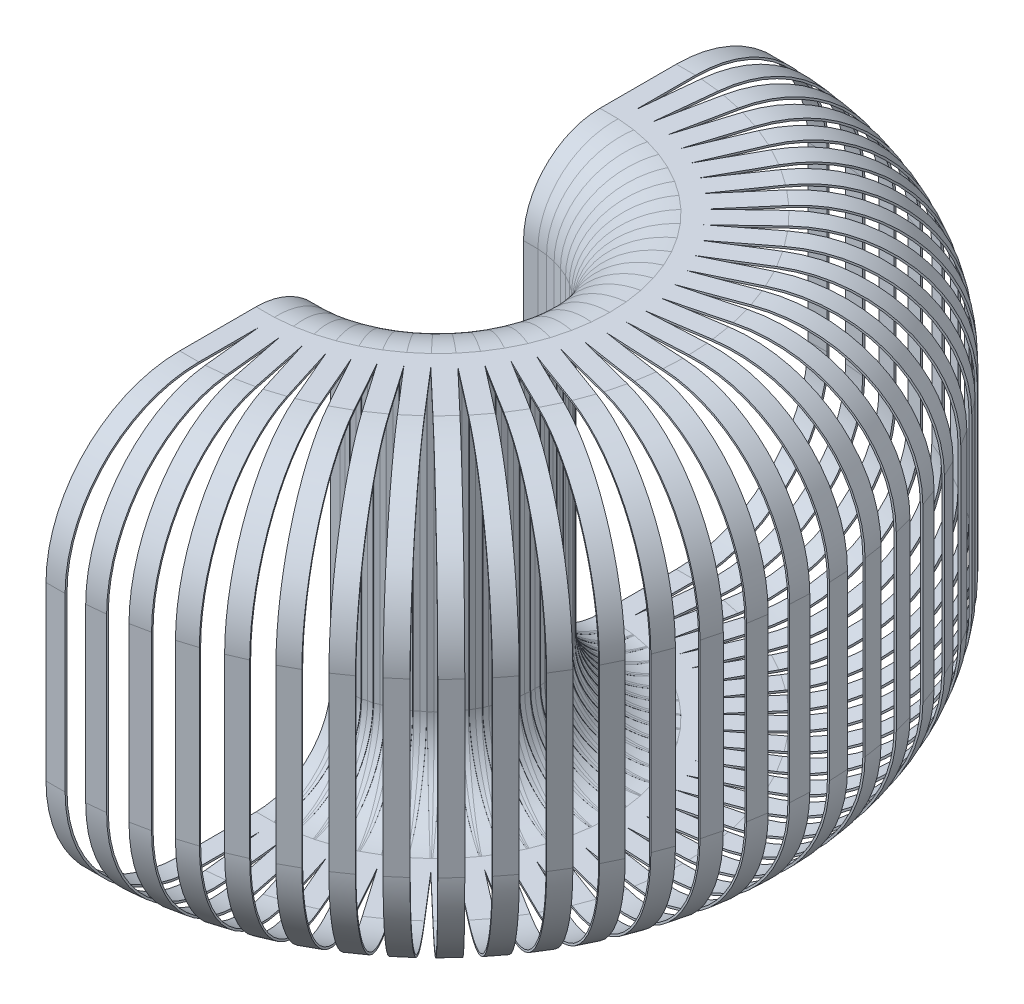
SolidWorks part; units mm, degrees
ref_plane "Alzado" through (0, 0, 0) normal (0, 0, 1) x (1, 0, 0)
ref_plane "Planta" through (0, 0, 0) normal (0, 1, 0) x (1, 0, 0)
ref_plane "Vista lateral" through (0, 0, 0) normal (1, 0, 0) x (0, 0, -1)
sketch "Croquis1" plane through (0, 0, 0) normal (1, 0, 0) x (0, 0, -1)
  line L0 (0, -115) -> (0, 115) construction
  line L2 (200, 45) -> (200, -45)
  line L3 (130, -115) -> (90, -115)
  line L4 (130, 115) -> (90, 115)
  line L5 (50, 75) -> (50, -75)
  line L6 (199, 45) -> (199, -45)
  line L7 (130, -114) -> (90, -114)
  line L8 (51, 75) -> (51, -75)
  line L9 (130, 114) -> (90, 114)
  arc A0 (200, -45) -> (130, -115) centre (130, -45) cw
  arc A1 (130, 115) -> (200, 45) centre (130, 45) cw
  arc A2 (50, -75) -> (90, -115) centre (90, -75) ccw
  arc A3 (90, 115) -> (50, 75) centre (90, 75) ccw
  arc A4 (199, -45) -> (130, -114) centre (130, -45) cw
  arc A5 (51, -75) -> (90, -114) centre (90, -75) ccw
  arc A6 (90, 114) -> (51, 75) centre (90, 75) ccw
  arc A7 (130, 114) -> (199, 45) centre (130, 45) cw
  point P4 (0, 0)
  dimension "D2" = 70
  dimension "D3" = 70
  dimension "D4" = 40
  dimension "D5" = 40
  dimension "D1" = 230
  dimension "D6" = 1
extrude "Saliente-Extruir1" add sketch "Croquis1" along normal mid plane 10
sketch "Croquis2" plane through (0, 0, 0) normal (0, 0, 1) x (1, 0, 0)
  line L0 (0, 0) -> (0, 49.9452)
pattern_circular "MatrizC1" count 32 every 5.806 about axis through (0, 0, 0) along (0, 1, 0) of "Saliente-Extruir1"
